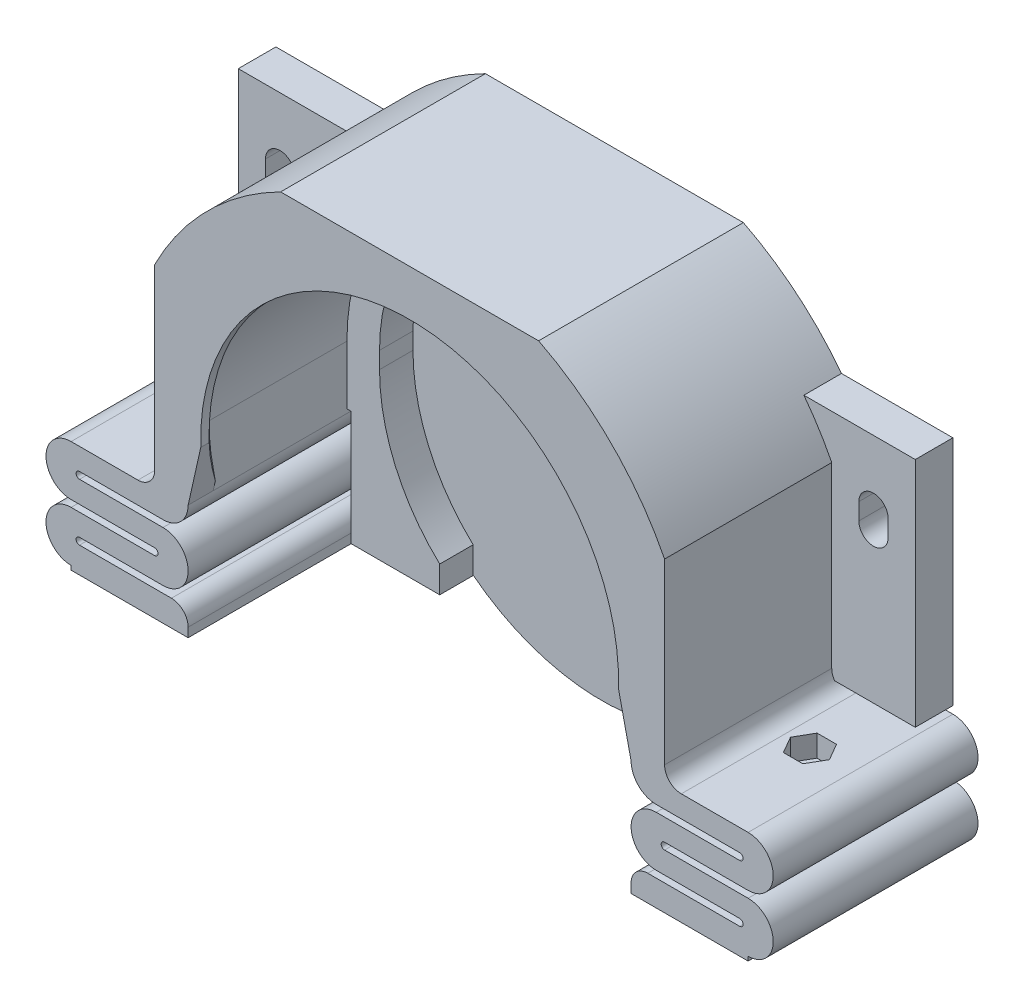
SolidWorks part; units mm, degrees
ref_plane "Спереди" through (0, 0, 0) normal (0, 0, 1) x (1, 0, 0)
ref_plane "Сверху" through (0, 0, 0) normal (0, 1, 0) x (1, 0, 0)
ref_plane "Справа" through (0, 0, 0) normal (1, 0, 0) x (0, 0, -1)
other "Графика1"
other "Графика (Закрыто) -1"
other "Графика (Закрыто) -2"
other "Графика (Закрыто) -3"
other "Графика (Закрыто) -4"
other "Графика (Закрыто) -5"
sketch "Эскиз1" plane through (0, 0, 0) normal (0, 0, 1) x (1, 0, 0)
  line L2 (-40.5, 20.7364) -> (-40.5, -7.6947)
  line L3 (-40.5, -20.7364) -> (40.5, -20.7364)
  line L4 (40.5, 20.7364) -> (40.5, -7.6947)
  line L6 (-40.5, 20.7364) -> (-27.1741, 20.7364)
  line L11 (27.1741, 20.7364) -> (40.5, 20.7364)
  line L12 (15.433, 30.5) -> (-15.433, 30.5)
  line L13 (0, 0) -> (0, -11.4005) construction
  line L14 (-40.5, -20.7364) -> (-43.7956, -20.7364)
  line L16 (-40.5, -7.6947) -> (-43.7956, -7.6947)
  line L17 (-43.7956, -20.7364) -> (-43.7956, -7.6947)
  line L18 (40.5, -7.6947) -> (43.7956, -7.6947)
  line L19 (43.7956, -20.7364) -> (43.7956, -7.6947)
  line L20 (40.5, -20.7364) -> (43.7956, -20.7364)
  arc A3 (27.1741, 20.7364) -> (15.433, 30.5) centre (0, 0) ccw
  arc A4 (-15.433, 30.5) -> (-27.1741, 20.7364) centre (0, 0) ccw
  point P0 (0, 0)
  point P7 (0, 0)
extrude "Бобышка-Вытянуть1" add sketch "Эскиз1" along normal blind 24.5
sketch "Эскиз2" plane through (0, 0, 24.5) normal (0, 0, 1) x (1, 0, 0)
  line L0 (-2.8, 1) -> (-2.8, -1)
  line L6 (2.8, -1) -> (2.8, 1)
  line L7 (45.4952, -23.1532) -> (26.035, -23.1532)
  line L8 (-26.5, -14.319) -> (-26.5, -19.3202) construction
  line L9 (-40.5, 20.7364) -> (-40.5, -7.6947) construction
  line L12 (-40.5, -17.7306) -> (-45.4952, -17.7306) construction
  line L16 (-40.5, -17.7306) -> (-39.5, -17.7306) construction
  line L21 (-39.5, -10.5016) -> (-29.5058, -10.5016)
  line L23 (-31.5712, -14.7248) -> (-31.5712, -20.7364) construction
  line L29 (-29.5058, -14.319) -> (-30.5058, -14.319) construction
  line L30 (32.5058, -7.9016) -> (40.5, -7.9016)
  line L31 (-26.5, -13.9132) -> (-26.5275, -13.9132)
  line L32 (-29.5058, -11.3132) -> (-39.5, -11.3132)
  line L33 (-40.5, -13.9132) -> (-30.5058, -13.9132)
  line L34 (-30.5058, -14.7248) -> (-40.5, -14.7248)
  line L35 (-40.5, -20.7364) -> (-26.5, -20.7364)
  line L36 (-43.7956, -20.7364) -> (43.7956, -20.7364) construction
  line L39 (-29.5058, -17.3248) -> (-26.035, -17.3248) construction
  line L40 (-29.4666, -10.5016) -> (-29.5058, -10.5016)
  line L41 (-30.5058, -5.9016) -> (-30.5058, 15.4215)
  line L42 (-29.5058, -10.5016) -> (-26.035, -10.5016) construction
  line L43 (-26.5, -7.4957) -> (-26.5, -12.497) construction
  line L44 (0, 0) -> (0, -12.497) construction
  line L47 (-31.5712, -7.9016) -> (-31.5712, -13.9132) construction
  line L48 (-39.5, -17.3248) -> (-29.5058, -17.3248)
  line L49 (-40.5, -10.9074) -> (-45.4952, -10.9074) construction
  line L50 (-40.5, -10.9074) -> (-39.5, -10.9074) construction
  line L51 (-40.5, -7.9016) -> (-32.5058, -7.9016)
  line L52 (-39.5, -18.1364) -> (-28.5, -18.1364)
  line L53 (-26.5, -20.1364) -> (-26.5, -20.7364)
  line L54 (40.5, -10.9074) -> (39.5, -10.9074) construction
  line L55 (40.5, -10.9074) -> (45.4952, -10.9074) construction
  line L56 (31.5712, -7.9016) -> (31.5712, -13.9132) construction
  line L57 (26.5, -7.4957) -> (26.5, -12.497) construction
  line L58 (29.5058, -10.5016) -> (26.035, -10.5016) construction
  line L59 (29.5058, -17.3248) -> (26.035, -17.3248) construction
  line L60 (29.5058, -14.319) -> (30.5058, -14.319) construction
  line L61 (31.5712, -14.7248) -> (31.5712, -20.7364) construction
  line L62 (40.5, -17.7306) -> (39.5, -17.7306) construction
  line L63 (40.5, -17.7306) -> (45.4952, -17.7306) construction
  line L64 (26.5, -14.319) -> (26.5, -19.3202) construction
  line L65 (26.5, -20.1364) -> (26.5, -20.7364)
  line L66 (39.5, -18.1364) -> (28.5, -18.1364)
  line L67 (-26.5, -7.4957) -> (-26.5, 0)
  line L68 (-45.4952, -7.0145) -> (-26.035, -7.0145)
  line L69 (39.5, -17.3248) -> (29.5058, -17.3248)
  line L72 (29.4666, -10.5016) -> (29.5058, -10.5016)
  line L73 (40.5, -20.7364) -> (26.5, -20.7364)
  line L74 (30.5058, -14.7248) -> (40.5, -14.7248)
  line L75 (40.5, -13.9132) -> (30.5058, -13.9132)
  line L76 (29.5058, -11.3132) -> (39.5, -11.3132)
  line L77 (26.5, -13.9132) -> (26.5275, -13.9132)
  line L78 (-45.4952, -7.0145) -> (-45.4952, -23.1532)
  line L80 (39.5, -10.5016) -> (29.5058, -10.5016)
  line L81 (30.5058, -5.9016) -> (30.5058, 15.4215)
  line L82 (-45.4952, -23.1532) -> (-26.035, -23.1532)
  line L87 (-26.035, -7.0145) -> (-26.035, -23.1532)
  line L88 (26.035, -7.0145) -> (26.035, -23.1532)
  line L90 (45.4952, -7.0145) -> (26.035, -7.0145)
  line L91 (45.4952, -7.0145) -> (45.4952, -23.1532)
  line L92 (-40.5, -7.9016) -> (-40.5, -20.7364) construction
  line L101 (26.5, -7.4957) -> (26.5, 0)
  line L123 (15.433, 30.5) -> (-15.433, 30.5)
  arc A0 (-29.4667, -17.3245) -> (-29.4666, -17.3248) centre (0, 0) ccw
  arc A1 (2.8, 1) -> (-2.8, 1) centre (0, 1) ccw
  arc A2 (-2.8, -1) -> (2.8, -1) centre (0, -1) ccw
  arc A3 (26.5, 0) -> (-26.5, 0) centre (0, 0) ccw
  arc A4 (-40.5, -14.7248) -> (-40.5, -20.7364) centre (-40.5, -17.7306) ccw
  arc A5 (-39.5, -17.3248) -> (-39.5, -18.1364) centre (-39.5, -17.7306) ccw
  arc A6 (-26.5, -7.4957) -> (-29.5058, -10.5016) centre (-29.5058, -7.4957) cw
  arc A7 (-40.5, -7.9016) -> (-40.5, -13.9132) centre (-40.5, -10.9074) ccw
  arc A8 (-29.5058, -11.3132) -> (-29.5058, -17.3248) centre (-29.5058, -14.319) cw
  arc A9 (-30.5058, -13.9132) -> (-30.5058, -14.7248) centre (-30.5058, -14.319) cw
  arc A10 (-39.5, -10.5016) -> (-39.5, -11.3132) centre (-39.5, -10.9074) ccw
  arc A12 (39.5, -10.5016) -> (39.5, -11.3132) centre (39.5, -10.9074) cw
  arc A13 (30.5058, -13.9132) -> (30.5058, -14.7248) centre (30.5058, -14.319) ccw
  arc A14 (29.5058, -11.3132) -> (29.5058, -17.3248) centre (29.5058, -14.319) ccw
  arc A15 (40.5, -7.9016) -> (40.5, -13.9132) centre (40.5, -10.9074) cw
  arc A16 (26.5, -7.4957) -> (29.5058, -10.5016) centre (29.5058, -7.4957) ccw
  arc A17 (39.5, -17.3248) -> (39.5, -18.1364) centre (39.5, -17.7306) cw
  arc A18 (40.5, -14.7248) -> (40.5, -20.7364) centre (40.5, -17.7306) cw
  arc A19 (29.4667, -17.3245) -> (29.4666, -17.3248) centre (0, 0) cw
  arc A20 (32.5058, -7.9016) -> (30.5058, -5.9016) centre (32.5058, -5.9016) cw
  arc A21 (-30.5058, -5.9016) -> (-32.5058, -7.9016) centre (-32.5058, -5.9016) cw
  arc A22 (26.5, -20.1364) -> (28.5, -18.1364) centre (28.5, -20.1364) cw
  arc A23 (-28.5, -18.1364) -> (-26.5, -20.1364) centre (-28.5, -20.1364) cw
  arc A28 (30.5058, 15.4215) -> (15.433, 30.5) centre (0, 0) ccw
  arc A29 (-15.433, 30.5) -> (-30.5058, 15.4215) centre (0, 0) ccw
  point P104 (30.5058, -7.9016)
  point P107 (-30.5058, -7.9016)
  point P110 (26.5, -18.1364)
  point P113 (-26.5, -18.1364)
  dimension "D1" = 2
  dimension "D2" = 2
sketch "Эскиз3" plane through (0, 0, 24.5) normal (0, 0, 1) x (1, 0, 0)
  line L0 (-2.8, 1) -> (-2.8, -1)
  line L1 (2.8, -1) -> (2.8, 1)
  line L2 (45.4952, -23.1532) -> (26.035, -23.1532)
  line L3 (-26.5, -14.319) -> (-26.5, -19.3202) construction
  line L4 (-40.5, -17.7306) -> (-45.4952, -17.7306) construction
  line L5 (-40.5, -17.7306) -> (-39.5, -17.7306) construction
  line L6 (-39.5, -10.5016) -> (-29.5058, -10.5016)
  line L7 (-31.5712, -14.7248) -> (-31.5712, -20.7364) construction
  line L8 (-29.5058, -14.319) -> (-30.5058, -14.319) construction
  line L9 (32.5058, -7.9016) -> (40.5, -7.9016)
  line L10 (-26.5, -13.9132) -> (-26.5275, -13.9132)
  line L11 (-29.5058, -11.3132) -> (-39.5, -11.3132)
  line L12 (-40.5, -13.9132) -> (-30.5058, -13.9132)
  line L13 (-30.5058, -14.7248) -> (-40.5, -14.7248)
  line L14 (-40.5, -20.7364) -> (-26.5, -20.7364)
  line L15 (-29.5058, -17.3248) -> (-26.035, -17.3248) construction
  line L16 (-29.4666, -10.5016) -> (-29.5058, -10.5016)
  line L17 (-29.5058, -10.5016) -> (-26.035, -10.5016) construction
  line L18 (-26.5, -7.4957) -> (-26.5, -12.497) construction
  line L19 (-31.5712, -7.9016) -> (-31.5712, -13.9132) construction
  line L20 (-39.5, -17.3248) -> (-29.5058, -17.3248)
  line L21 (-40.5, -10.9074) -> (-45.4952, -10.9074) construction
  line L22 (-40.5, -10.9074) -> (-39.5, -10.9074) construction
  line L23 (-40.5, -7.9016) -> (-32.5058, -7.9016)
  line L24 (-39.5, -18.1364) -> (-28.5, -18.1364)
  line L25 (-26.5, -20.1364) -> (-26.5, -20.7364)
  line L26 (40.5, -10.9074) -> (39.5, -10.9074) construction
  line L27 (40.5, -10.9074) -> (45.4952, -10.9074) construction
  line L28 (31.5712, -7.9016) -> (31.5712, -13.9132) construction
  line L29 (26.5, -7.4957) -> (26.5, -12.497) construction
  line L30 (29.5058, -10.5016) -> (26.035, -10.5016) construction
  line L31 (29.5058, -17.3248) -> (26.035, -17.3248) construction
  line L32 (29.5058, -14.319) -> (30.5058, -14.319) construction
  line L33 (31.5712, -14.7248) -> (31.5712, -20.7364) construction
  line L34 (40.5, -17.7306) -> (39.5, -17.7306) construction
  line L35 (40.5, -17.7306) -> (45.4952, -17.7306) construction
  line L36 (26.5, -14.319) -> (26.5, -19.3202) construction
  line L37 (26.5, -20.1364) -> (26.5, -20.7364)
  line L38 (39.5, -18.1364) -> (28.5, -18.1364)
  line L39 (-45.4952, -7.0145) -> (-30.8441, -7.0145)
  line L40 (39.5, -17.3248) -> (29.5058, -17.3248)
  line L41 (29.4666, -10.5016) -> (29.5058, -10.5016)
  line L42 (40.5, -20.7364) -> (26.5, -20.7364)
  line L43 (30.5058, -14.7248) -> (40.5, -14.7248)
  line L44 (40.5, -13.9132) -> (30.5058, -13.9132)
  line L45 (29.5058, -11.3132) -> (39.5, -11.3132)
  line L46 (26.5, -13.9132) -> (26.5275, -13.9132)
  line L47 (-45.4952, -7.0145) -> (-45.4952, -23.1532)
  line L48 (39.5, -10.5016) -> (29.5058, -10.5016)
  line L49 (-45.4952, -23.1532) -> (-26.035, -23.1532)
  line L50 (-26.035, -7.0145) -> (-26.035, -23.1532)
  line L51 (26.035, -7.0145) -> (26.035, -23.1532)
  line L52 (45.4952, -7.0145) -> (30.8441, -7.0145)
  line L53 (45.4952, -7.0145) -> (45.4952, -23.1532)
  line L54 (-26.5, -7.4957) -> (-26.5, -7.0145)
  line L56 (26.5, -7.4957) -> (26.5, -7.0145)
  line L58 (26.5, -7.0145) -> (26.035, -7.0145)
  line L59 (-26.5, -7.0145) -> (-26.035, -7.0145)
  arc A0 (-29.4667, -17.3245) -> (-29.4666, -17.3248) centre (0, 0) ccw
  arc A1 (2.8, 1) -> (-2.8, 1) centre (0, 1) ccw
  arc A2 (-2.8, -1) -> (2.8, -1) centre (0, -1) ccw
  arc A3 (-40.5, -14.7248) -> (-40.5, -20.7364) centre (-40.5, -17.7306) ccw
  arc A4 (-39.5, -17.3248) -> (-39.5, -18.1364) centre (-39.5, -17.7306) ccw
  arc A5 (-26.5, -7.4957) -> (-29.5058, -10.5016) centre (-29.5058, -7.4957) cw
  arc A6 (-40.5, -7.9016) -> (-40.5, -13.9132) centre (-40.5, -10.9074) ccw
  arc A7 (-29.5058, -11.3132) -> (-29.5058, -17.3248) centre (-29.5058, -14.319) cw
  arc A8 (-30.5058, -13.9132) -> (-30.5058, -14.7248) centre (-30.5058, -14.319) cw
  arc A9 (-39.5, -10.5016) -> (-39.5, -11.3132) centre (-39.5, -10.9074) ccw
  arc A10 (39.5, -10.5016) -> (39.5, -11.3132) centre (39.5, -10.9074) cw
  arc A11 (30.5058, -13.9132) -> (30.5058, -14.7248) centre (30.5058, -14.319) ccw
  arc A12 (29.5058, -11.3132) -> (29.5058, -17.3248) centre (29.5058, -14.319) ccw
  arc A13 (40.5, -7.9016) -> (40.5, -13.9132) centre (40.5, -10.9074) cw
  arc A14 (26.5, -7.4957) -> (29.5058, -10.5016) centre (29.5058, -7.4957) ccw
  arc A15 (39.5, -17.3248) -> (39.5, -18.1364) centre (39.5, -17.7306) cw
  arc A16 (40.5, -14.7248) -> (40.5, -20.7364) centre (40.5, -17.7306) cw
  arc A17 (29.4667, -17.3245) -> (29.4666, -17.3248) centre (0, 0) cw
  arc A18 (32.5058, -7.9016) -> (30.8441, -7.0145) centre (32.5058, -5.9016) cw
  arc A19 (-30.8441, -7.0145) -> (-32.5058, -7.9016) centre (-32.5058, -5.9016) cw
  arc A20 (26.5, -20.1364) -> (28.5, -18.1364) centre (28.5, -20.1364) cw
  arc A21 (-28.5, -18.1364) -> (-26.5, -20.1364) centre (-28.5, -20.1364) cw
  dimension "D1" = 2
  dimension "D2" = 2
extrude "Вырез-Вытянуть2" cut sketch "Эскиз3" against normal blind 24.5 contours L0 A2 L1 A1 | L6 A9 L11 A7 L20 A4 L24 A21 L25 L14 A3 L13 A8 L12 A6 L23 A19 L39 L47 L49 L50 L59 L54 A5 | A14 L56 L58 L51 L2 L53 L52 A18 L9 A13 L44 A11 L43 A16 L42 L37 A20 L38 A15 L40 A12 L45 A10 L48
sketch "Эскиз4" plane through (0, 0, 24.5) normal (0, 0, 1) x (1, 0, 0)
  line L0 (-40.5, -7.0145) -> (-30.8441, -7.0145)
  line L1 (-30.5058, 15.4215) -> (-30.5058, -5.9016)
  line L2 (-40.5, -7.0145) -> (-40.5, 20.7364)
  line L3 (-40.5, 20.7364) -> (-27.1741, 20.7364)
  line L4 (0, 0) -> (0, -10.9281) construction
  line L5 (0, 0) -> (0, -12.497) construction
  line L6 (40.5, 20.7364) -> (27.1741, 20.7364)
  line L7 (40.5, -7.0145) -> (40.5, 20.7364)
  line L8 (30.5058, 15.4215) -> (30.5058, -5.9016)
  line L9 (40.5, -7.0145) -> (30.8441, -7.0145)
  arc A0 (-27.1741, 20.7364) -> (-30.5058, 15.4215) centre (0, 0) ccw
  arc A1 (-30.8441, -7.0145) -> (-30.5058, -5.9016) centre (-32.5058, -5.9016) ccw
  arc A2 (30.8441, -7.0145) -> (30.5058, -5.9016) centre (32.5058, -5.9016) cw
  arc A3 (27.1741, 20.7364) -> (30.5058, 15.4215) centre (0, 0) cw
extrude "Вырез-Вытянуть3" cut sketch "Эскиз4" against normal blind 20
sketch "Эскиз5" plane through (0, 0, 24.5) normal (0, 0, 1) x (1, 0, 0)
  line L0 (-15.3964, -17.5442) -> (-15.3964, -30.4684)
  line L2 (-22.6, 1) -> (-22.6, -1)
  line L3 (-15.3964, -30.4684) -> (15.3964, -30.4684)
  line L4 (22.6, 1) -> (22.6, -1)
  line L5 (0, -1) -> (0, -13.864) construction
  line L6 (15.3964, -17.5442) -> (15.3964, -30.4684)
  arc A0 (22.6, 1) -> (-22.6, 1) centre (0, 1) ccw
  arc A1 (-22.6, -1) -> (-15.3964, -17.5442) centre (0, -1) ccw
  arc A2 (15.3964, -17.5442) -> (22.6, -1) centre (0, -1) ccw
extrude "Вырез-Вытянуть4" cut sketch "Эскиз5" against normal blind 23
sketch "Эскиз6" plane through (0, 0, 24.5) normal (0, 0, 1) x (1, 0, 0)
  line L2 (-26.5, 0) -> (-26.5, -27.7059)
  line L3 (-26.5, -27.7059) -> (26.5, -27.7059)
  line L4 (26.5, 0) -> (26.5, -27.7059)
  arc A0 (26.5, 0) -> (-26.5, 0) centre (0, 0) ccw
extrude "Вырез-Вытянуть5" cut sketch "Эскиз6" against normal blind 19
sketch "Эскиз7" plane through (0, -20.7364, 0) normal (0, -1, 0) x (1, 0, 0)
  line L0 (0, 0) -> (0, 19.5942) construction
  line L1 (-40.5, 24.5) -> (-26.5, 24.5)
  line L2 (-40.5, 24.5) -> (-40.5, 0)
  line L3 (-40.5, 0) -> (-26.5, 0)
  line L4 (-26.5, 24.5) -> (-26.5, 0)
  line L5 (-26.035, 0) -> (26.035, 0) construction
  line L6 (40.5, 0) -> (26.5, 0)
  line L7 (26.5, 24.5) -> (26.5, 0)
  line L8 (40.5, 24.5) -> (26.5, 24.5)
  line L9 (40.5, 24.5) -> (40.5, 0)
extrude "Бобышка-Вытянуть2" add sketch "Эскиз7" along normal blind 0.5
sketch "Эскиз8" plane through (0, 0, 0) normal (0, 0, -1) x (-1, 0, 0)
  circle A0 centre (0, -1) radius 25
  circle A1 centre (0, 0) radius 10.2421
extrude "Бобышка-Вытянуть3" add sketch "Эскиз8" against normal up to surface (1.5 mm away)
sketch "Эскиз9" plane through (0, 0, 0) normal (0, 0, 1) x (1, 0, 0)
  line L0 (-33.75, 11.0001) -> (-33.75, 13)
  line L1 (-37.25, 13) -> (-37.25, 11.0001)
  line L2 (0, 0) -> (0, -12.497) construction
  line L3 (37.25, 13) -> (37.25, 11.0001)
  line L4 (33.75, 11.0001) -> (33.75, 13)
  arc A0 (-33.75, 13) -> (-37.25, 13) centre (-35.5, 13) ccw
  arc A2 (-37.25, 11.0001) -> (-33.75, 11.0001) centre (-35.5, 11) ccw
  arc A3 (37.25, 11.0001) -> (33.75, 11.0001) centre (35.5, 11) cw
  arc A4 (33.75, 13) -> (37.25, 13) centre (35.5, 13) cw
extrude "Вырез-Вытянуть9" cut sketch "Эскиз9" along normal blind 19
sketch "Эскиз10" plane through (0, 0, 0) normal (0, 1, 0) x (1, 0, 0)
  line L0 (-34.3363, -10.0843) -> (-34.3363, -14.1157) construction
  line L1 (-34.3363, -10.0843) -> (-36.6638, -10.0843)
  line L2 (-36.6638, -10.0843) -> (-37.8276, -12.1)
  line L3 (-37.8276, -12.1) -> (-36.6639, -14.1157)
  line L4 (-36.6639, -14.1157) -> (-34.3364, -14.1157)
  line L5 (-34.3364, -14.1157) -> (-33.1726, -12.1)
  line L6 (-33.1726, -12.1) -> (-34.3363, -10.0843)
  line L7 (36.6637, -10.0843) -> (36.6637, -14.1157) construction
  line L8 (36.6636, -14.1157) -> (37.8274, -12.1)
  line L9 (37.8274, -12.1) -> (36.6637, -10.0843)
  line L10 (34.3361, -14.1157) -> (36.6636, -14.1157)
  line L11 (36.6637, -10.0843) -> (34.3362, -10.0843)
  line L12 (34.3362, -10.0843) -> (33.1724, -12.1)
  line L13 (33.1724, -12.1) -> (34.3361, -14.1157)
  line L14 (36.6637, -10.0843) -> (36.6637, -14.1157) construction
  circle A0 centre (-35.5001, -12.1) radius 2.0157 construction
  circle A1 centre (35.4999, -12.1) radius 2.0157 construction
extrude "Вырез-Вытянуть10" cut sketch "Эскиз10" against normal through all
sketch "Эскиз11" plane through (0, 0, 1.5) normal (0, 0, 1) x (1, 0, 0)
  line L0 (-2.8, 1) -> (-2.8, -1)
  line L2 (2.8, 1) -> (2.8, -1)
  arc A1 (-2.8, -1) -> (2.8, -1) centre (0, -1) ccw
  arc A2 (2.8, 1) -> (-2.8, 1) centre (0, 1) ccw
  circle A3 centre (0, 0) radius 6
extrude "Бобышка-Вытянуть4" add sketch "Эскиз11" along normal blind 0.4
sketch "Эскиз12" plane through (0, 0, 24.5) normal (0, 0, 1) x (1, 0, 0)
  line L0 (-26.5, 0) -> (-26.5, -7.4957)
  line L1 (-26.5, -7.4957) -> (-24.9886, -0.7534)
  line L2 (0, -12.497) -> (0, 0) construction
  line L3 (26.5, -7.4957) -> (24.9886, -0.7534)
  line L4 (26.5, 0) -> (26.5, -7.4957)
  arc A0 (26.5, 0) -> (-26.5, 0) centre (0, 0) ccw
  arc A3 (24.9886, -0.7534) -> (-24.9886, -0.7534) centre (0, 0) ccw
extrude "Бобышка-Вытянуть5" add sketch "Эскиз12" against normal blind 3
chamfer "Фаска1" distance 2 angle 45 1 edges at (0, 25, 21.5)
sketch "Эскиз14" plane through (0, -21.2364, 0) normal (0, -1, 0) x (1, 0, 0)
  line L0 (0, 1.9) -> (0, 23.5)
  line L1 (6, 1.9) -> (-6, 1.9) construction
  line L2 (-25, 23.5) -> (25, 23.5) construction
